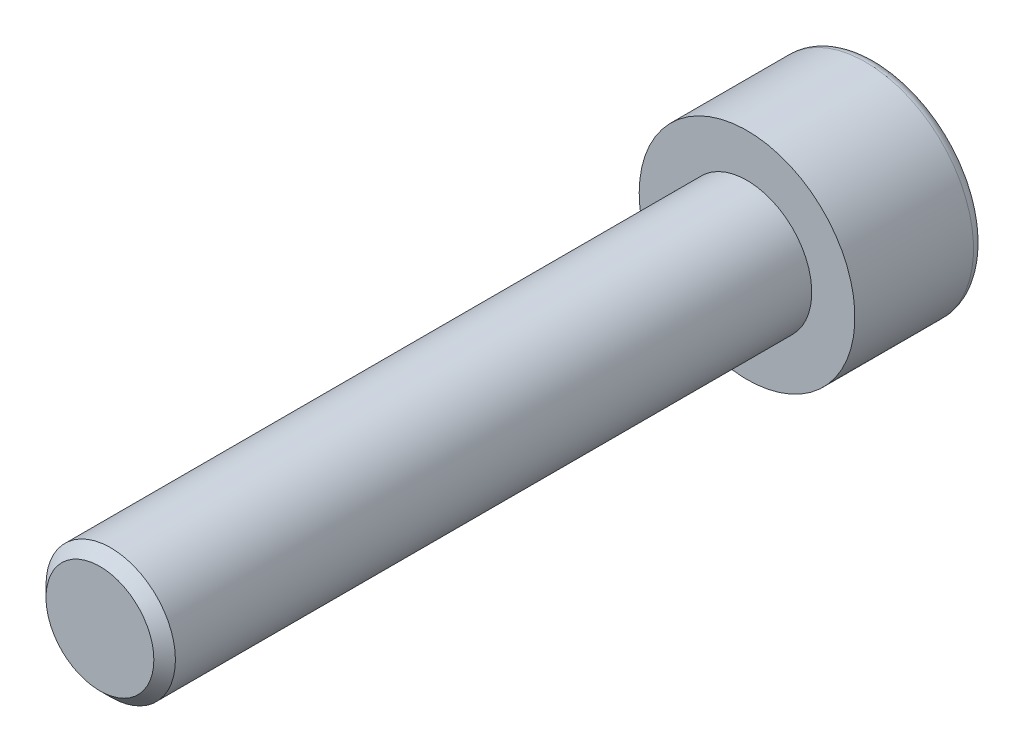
SolidWorks part; units mm, degrees
ref_plane "Face" through (0, 0, 0) normal (0, 0, 1) x (1, 0, 0)
ref_plane "Dessus" through (0, 0, 0) normal (0, 1, 0) x (1, 0, 0)
ref_plane "Droite" through (0, 0, 0) normal (1, 0, 0) x (0, 0, -1)
sketch "Esquisse1" plane through (0, 0, 0) normal (0, 0, 1) x (1, 0, 0)
  circle A0 centre (0, 0) radius 3
  dimension "D1" = 6
extrude "Base-Extrusion" add sketch "Esquisse1" along normal blind 30
chamfer "Chanfrein1" distance 0.5 angle 45 1 edges at (3, 0, 30)
sketch "Esquisse2" plane through (0, 0, 0) normal (0, 0, -1) x (-1, 0, 0)
  circle A0 centre (0, 0) radius 5
  dimension "D1" = 10
extrude "Boss.-Extru.1" add sketch "Esquisse2" along normal blind 6
fillet "Congé1" radius 0.5 1 edges at (-5, 0, -6)
sketch "Esquisse3" plane through (0, 0, -6) normal (0, 0, -1) x (-1, 0, 0)
  line L1 (0, 2.8868) -> (-2.5, 1.4434)
  line L2 (-2.5, 1.4434) -> (-2.5, -1.4434)
  line L3 (-2.5, -1.4434) -> (0, -2.8868)
  line L4 (0, -2.8868) -> (2.5, -1.4434)
  line L5 (2.5, -1.4434) -> (2.5, 1.4434)
  line L6 (2.5, 1.4434) -> (0, 2.8868)
  circle A0 centre (0, 0) radius 2.5 construction
  dimension "D1" = 5
extrude "Enlèv. mat.-Extru.1" cut sketch "Esquisse3" against normal blind 4
